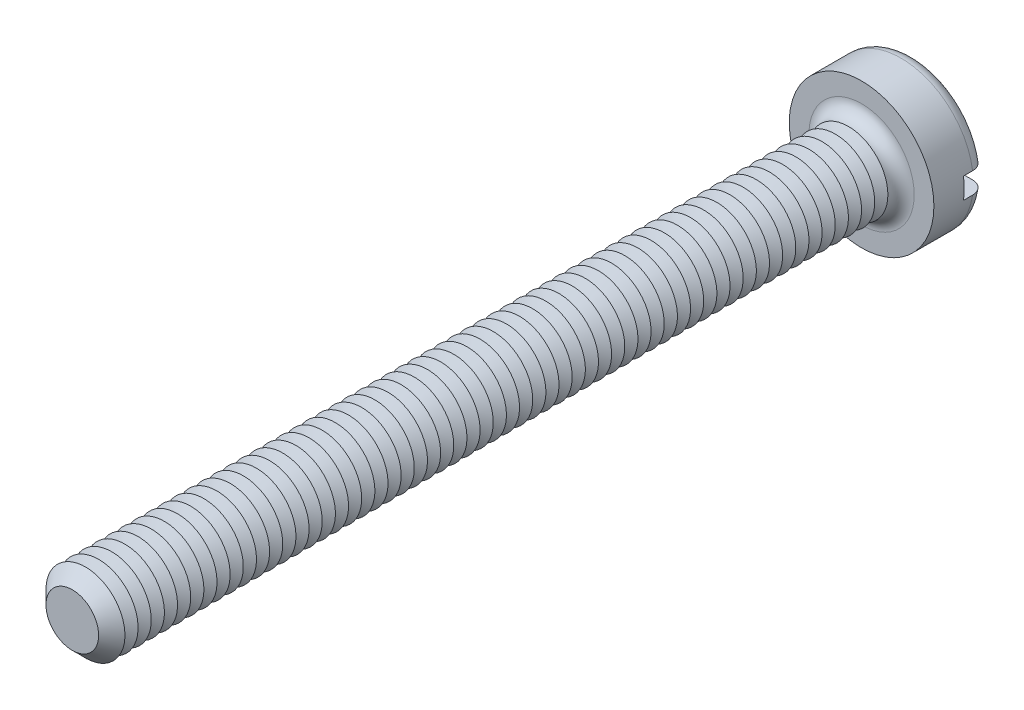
SolidWorks part; units mm, degrees
ref_plane "Front Plane" through (0, 0, 0) normal (0, 0, 1) x (1, 0, 0)
ref_plane "Top Plane" through (0, 0, 0) normal (0, 1, 0) x (1, 0, 0)
ref_plane "Right Plane" through (0, 0, 0) normal (1, 0, 0) x (0, 0, -1)
sketch "Sketch3" plane through (0, 0, 0) normal (0, 0, 1) x (1, 0, 0)
  circle A0 centre (0, 0) radius 2.75
  dimension "D1" = 5.5
extrude "Boss-Extrude2" add sketch "Sketch3" against normal blind 2
sketch "Sketch4" plane through (0, 0, 0) normal (0, 0, 1) x (1, 0, 0)
  circle A0 centre (0, 0) radius 1.5
  dimension "D1" = 3
extrude "Boss-Extrude3" add sketch "Sketch4" along normal blind 30
fillet "Fillet1" radius 0.5 2 edges at (2.75, 0, -2) (1.5, 0, 0)
chamfer "Chamfer1" distance 0.5 angle 45 1 edges at (1.5, 0, 30)
sketch "Sketch5" plane through (0, 0, 0) normal (1, 0, 0) x (0, 0, -1)
  line L0 (1.6944, 0) -> (-7.6738, 0) construction
sketch "Sketch6" plane through (0, 0, 0) normal (1, 0, 0) x (0, 0, -1)
  line L0 (-0.5, 1.5) -> (-0.75, 1.067)
  line L1 (-0.75, 1.067) -> (-1, 1.5)
  line L2 (-0.5, 1.5) -> (-29.5, 1.5) construction
  line L3 (-1, 1.5) -> (-0.5, 1.5)
  dimension "D1" = 0.5
revolve "Cut-Revolve1" cut sketch "Sketch6" angle 360 about L0
pattern_linear "LPattern1" count 58 spacing 0.5 along (0, 0, 1) of "Cut-Revolve1"
sketch "Sketch8" plane through (0, 0, -2) normal (0, 0, -1) x (-1, 0, 0)
  line L1 (2.75, -0.4) -> (-2.75, -0.4)
  line L2 (2.75, -0.4) -> (2.75, 0.4)
  line L3 (2.75, 0.4) -> (-2.75, 0.4)
  line L4 (-2.75, -0.4) -> (-2.75, 0.4)
  line L5 (2.75, -0.4) -> (-2.75, 0.4) construction
  line L6 (2.75, 0.4) -> (-2.75, -0.4) construction
  point P0 (0, 0)
  dimension "D1" = 5.5
  dimension "D2" = 0.8
extrude "Cut-Extrude1" cut sketch "Sketch8" against normal blind 0.85
